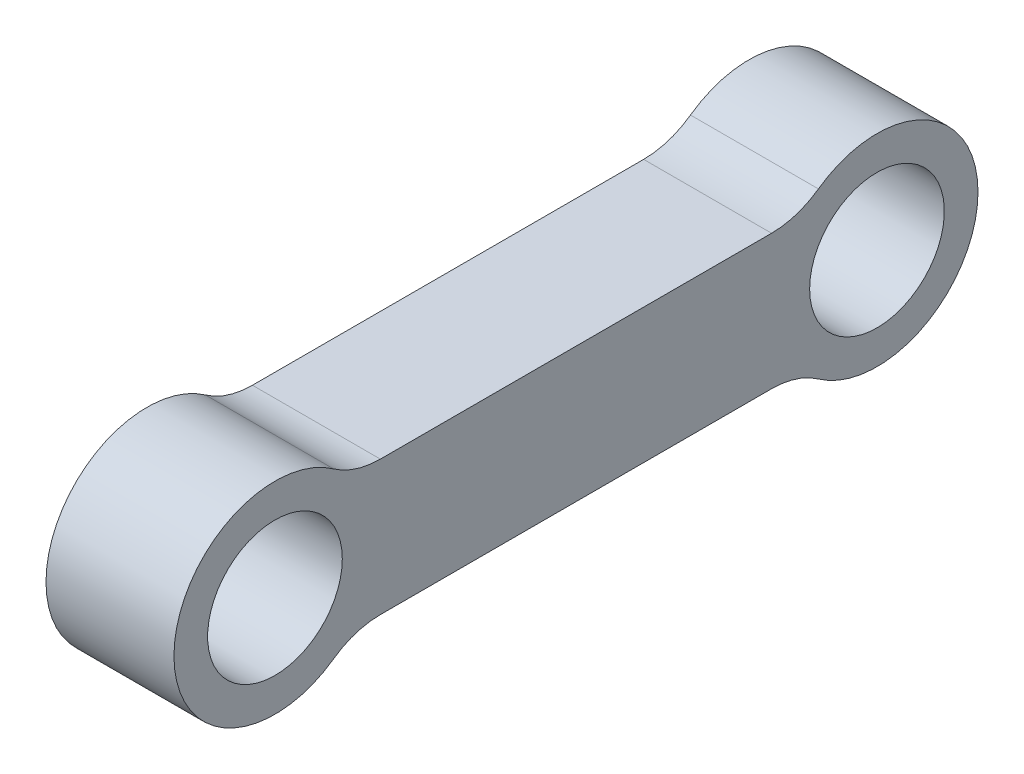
SolidWorks part; units mm, degrees
ref_plane "Front Plane" through (0, 0, 0) normal (0, 0, 1) x (1, 0, 0)
ref_plane "Top Plane" through (0, 0, 0) normal (0, 1, 0) x (1, 0, 0)
ref_plane "Right Plane" through (0, 0, 0) normal (1, 0, 0) x (0, 0, -1)
sketch "Sketch1" plane through (0, 0, 0) normal (1, 0, 0) x (0, 0, -1)
  line L0 (-453.965, 0) -> (22244.2867, 0) construction
  line L1 (0, -453.965) -> (0, 22244.2867) construction
  line L2 (-16.7598, 5) -> (16.7598, 5)
  line L3 (-16.7598, -5) -> (16.7598, -5)
  arc A0 (-16.7598, 5) -> (-16.7598, -5) centre (-22.35, 0) ccw
  circle A1 centre (-22.35, 0) radius 5
  circle A2 centre (22.35, 0) radius 5
  arc A3 (16.7598, 5) -> (16.7598, -5) centre (22.35, 0) cw
  point P10 (0, 5)
  point P15 (0, -5)
  dimension "D1" = 10
  dimension "D2" = 7.5
  dimension "D3" = 10
  dimension "D4" = 44.7
extrude "Boss-Extrude1" add sketch "Sketch1" along normal mid plane 9.5
fillet "Fillet1" radius 6 4 edges at (0, -5, -16.7598) (0, -5, 16.7598) (0, 5, 16.7598) (0, 5, -16.7598)
